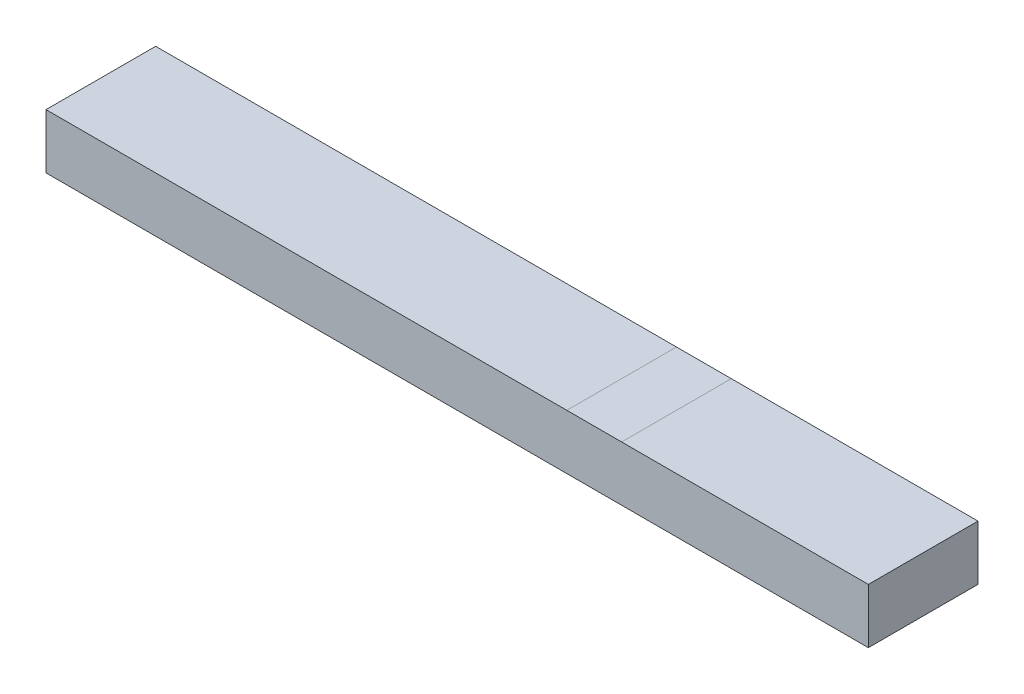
SolidWorks part; units mm, degrees
ref_plane "Front Plane" through (0, 0, 0) normal (0, 0, 1) x (1, 0, 0)
ref_plane "Top Plane" through (0, 0, 0) normal (0, 1, 0) x (1, 0, 0)
ref_plane "Right Plane" through (0, 0, 0) normal (1, 0, 0) x (0, 0, -1)
sketch "Sketch1" plane through (0, 0, 0) normal (1, 0, 0) x (0, 0, -1)
  line L1 (-50, -25) -> (50, -25)
  line L2 (-50, -25) -> (-50, 25)
  line L3 (-50, 25) -> (50, 25)
  line L4 (50, -25) -> (50, 25)
  line L5 (-50, -25) -> (50, 25) construction
  line L6 (-50, 25) -> (50, -25) construction
  point P0 (0, 0)
  dimension "D1" = 50
  dimension "D2" = 100
extrude "Boss-Extrude1" add sketch "Sketch1" along normal blind 750
sketch "Sketch2" plane through (0, 25, 0) normal (0, 1, 0) x (1, 0, 0)
  line L6 (475, 50) -> (475, -50)
  line L7 (750, 50) -> (0, 50) construction
  line L8 (750, -50) -> (0, -50) construction
  line L9 (525, 50) -> (525, -50)
  line L10 (750, 50) -> (750, -50) construction
  dimension "D1" = 50
  dimension "D2" = 225
